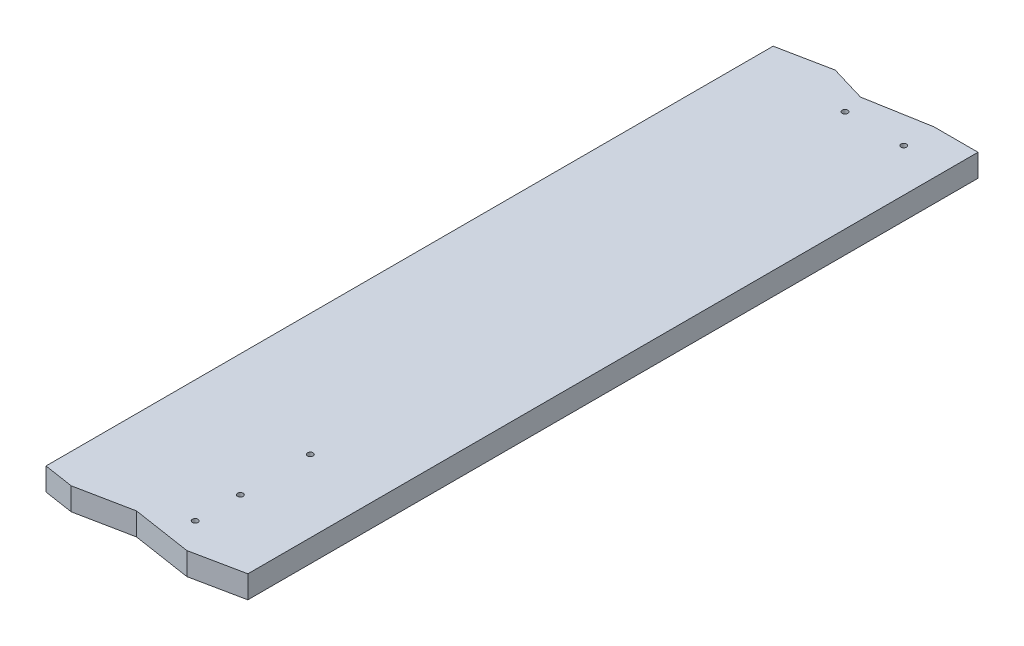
SolidWorks part; units mm, degrees
ref_plane "Front Plane" through (0, 0, 0) normal (0, 0, 1) x (1, 0, 0)
ref_plane "Top Plane" through (0, 0, 0) normal (0, 1, 0) x (1, 0, 0)
ref_plane "Right Plane" through (0, 0, 0) normal (1, 0, 0) x (0, 0, -1)
sketch "Sketch1" plane through (0, 0, 0) normal (0, 1, 0) x (1, 0, 0)
  line L0 (-33.795, 299.2658) -> (-10.86, 303.8528)
  line L1 (32.7417, 303.9478) -> (52.3195, 303.9478)
  line L2 (-33.795, 299.2658) -> (-33.795, -22.9573)
  line L4 (52.3195, 303.9478) -> (52.3195, -19.6113)
  line L5 (-10.86, 303.8528) -> (5.0883, 299.0808)
  line L6 (5.0883, 299.0808) -> (32.7417, 303.9478)
  line L7 (-33.795, -22.9573) -> (-20.6244, -24.9835)
  line L8 (-20.6244, -24.9835) -> (3.5172, -20.1552)
  line L9 (3.5172, -20.1552) -> (29.889, -24.2124)
  line L10 (29.889, -24.2124) -> (52.3195, -19.6113)
extrude "Extrude1" add sketch "Sketch1" along normal blind 10
sketch "Sketch2" plane through (0, 0, 0) normal (0, -1, 0) x (1, 0, 0)
  line L0 (20.3195, 10.9573) -> (20.3195, -9.0427) construction
  line L1 (52.3195, 19.6113) -> (52.3195, -303.9478) construction
  circle A0 centre (33.3195, -290.0427) radius 1.25
  circle A1 centre (20.3195, 10.9573) radius 1.25
  circle A2 centre (20.3195, -9.0427) radius 1.25
  circle A3 centre (20.3195, -40.0427) radius 1.25
  circle A4 centre (7.3195, -290.0427) radius 1.25
  dimension "D3" = 2.5
  dimension "D4" = 2.5
  dimension "D5" = 20
  dimension "D6" = 12
  dimension "D1" = 32
  dimension "D7" = 51
  dimension "D9" = 32
  dimension "D2" = 13
  dimension "D10" = 250
  dimension "D11" = 26
  dimension "D12" = 250
  dimension "D8" = 32
extrude "Extrude2" cut sketch "Sketch2" against normal blind 10
